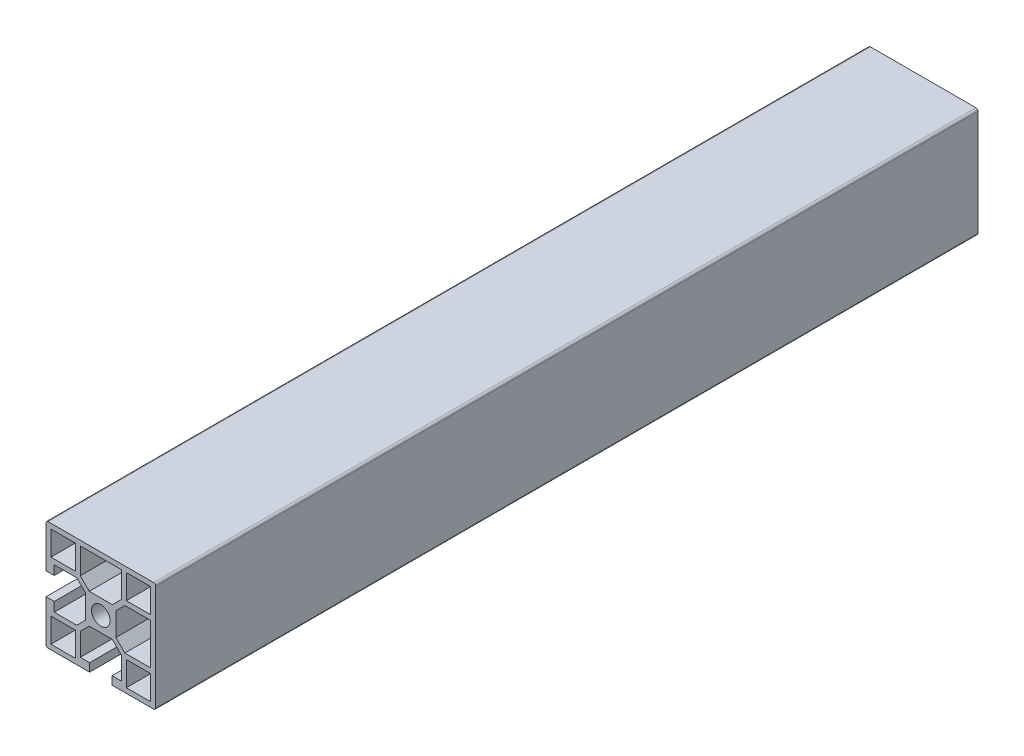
SolidWorks part; units mm, degrees
ref_plane "前视基准面" through (0, 0, 0) normal (0, 0, 1) x (1, 0, 0)
ref_plane "上视基准面" through (0, 0, 0) normal (0, 1, 0) x (1, 0, 0)
ref_plane "右视基准面" through (0, 0, 0) normal (1, 0, 0) x (0, 0, -1)
sketch "Model" plane through (0, 0, 0) normal (0, 0, 1) x (1, 0, 0)
  line L0 (8044.1793, 2616.1728) -> (8044.1793, 2607.2728)
  line L1 (8044.1793, 2607.2728) -> (8035.2793, 2607.2728)
  line L2 (8035.2793, 2607.2728) -> (8035.2793, 2616.1728)
  line L3 (8035.2793, 2616.1728) -> (8044.1793, 2616.1728)
  line L4 (8044.1793, 2643.6728) -> (8044.1793, 2634.7728)
  line L5 (8044.1793, 2634.7728) -> (8035.2793, 2634.7728)
  line L6 (8035.2793, 2634.7728) -> (8035.2793, 2643.6728)
  line L7 (8035.2793, 2643.6728) -> (8044.1793, 2643.6728)
  line L8 (8057.7065, 2630.9728) -> (8049.2521, 2630.9728)
  line L9 (8049.2521, 2630.9728) -> (8045.9793, 2634.2456)
  line L10 (8045.9793, 2634.2456) -> (8045.9793, 2643.6728)
  line L11 (8045.9793, 2643.6728) -> (8060.9793, 2643.6728)
  line L12 (8060.9793, 2643.6728) -> (8060.9793, 2634.2456)
  line L13 (8060.9793, 2634.2456) -> (8057.7065, 2630.9728)
  line L14 (8062.7793, 2607.2728) -> (8062.7793, 2616.1728)
  line L15 (8062.7793, 2616.1728) -> (8071.6793, 2616.1728)
  line L16 (8071.6793, 2616.1728) -> (8071.6793, 2607.2728)
  line L17 (8071.6793, 2607.2728) -> (8062.7793, 2607.2728)
  line L18 (8062.2521, 2632.9728) -> (8071.6793, 2632.9728)
  line L19 (8071.6793, 2632.9728) -> (8071.6793, 2617.9728)
  line L20 (8071.6793, 2617.9728) -> (8062.2521, 2617.9728)
  line L21 (8062.2521, 2617.9728) -> (8058.9793, 2621.2456)
  line L22 (8058.9793, 2621.2456) -> (8058.9793, 2629.7)
  line L23 (8058.9793, 2629.7) -> (8062.2521, 2632.9728)
  line L24 (8062.7793, 2634.7728) -> (8062.7793, 2643.6728)
  line L25 (8062.7793, 2643.6728) -> (8071.6793, 2643.6728)
  line L26 (8071.6793, 2643.6728) -> (8071.6793, 2634.7728)
  line L27 (8071.6793, 2634.7728) -> (8062.7793, 2634.7728)
  line L28 (8072.7293, 2645.4728) -> (8034.2293, 2645.4728)
  line L29 (8033.4793, 2644.7228) -> (8033.4793, 2629.5728)
  line L30 (8033.4793, 2629.5728) -> (8036.4793, 2629.5728)
  line L31 (8036.4793, 2629.5728) -> (8036.4793, 2632.9728)
  line L32 (8036.4793, 2632.9728) -> (8044.7065, 2632.9728)
  line L33 (8044.7065, 2632.9728) -> (8047.9793, 2629.7)
  line L34 (8047.9793, 2629.7) -> (8047.9793, 2621.2456)
  line L35 (8047.9793, 2621.2456) -> (8044.7065, 2617.9728)
  line L36 (8044.7065, 2617.9728) -> (8036.4793, 2617.9728)
  line L37 (8036.4793, 2617.9728) -> (8036.4793, 2621.3728)
  line L38 (8036.4793, 2621.3728) -> (8033.4793, 2621.3728)
  line L39 (8033.4793, 2621.3728) -> (8033.4793, 2606.2228)
  line L40 (8034.2293, 2605.4728) -> (8049.3793, 2605.4728)
  line L41 (8049.3793, 2605.4728) -> (8049.3793, 2608.4728)
  line L42 (8049.3793, 2608.4728) -> (8045.9793, 2608.4728)
  line L43 (8045.9793, 2608.4728) -> (8045.9793, 2616.7)
  line L44 (8045.9793, 2616.7) -> (8049.2521, 2619.9728)
  line L45 (8049.2521, 2619.9728) -> (8057.7065, 2619.9728)
  line L46 (8057.7065, 2619.9728) -> (8060.9793, 2616.7)
  line L47 (8060.9793, 2616.7) -> (8060.9793, 2608.4728)
  line L48 (8060.9793, 2608.4728) -> (8057.5793, 2608.4728)
  line L49 (8057.5793, 2608.4728) -> (8057.5793, 2605.4728)
  line L50 (8057.5793, 2605.4728) -> (8072.7293, 2605.4728)
  line L51 (8073.4793, 2606.2228) -> (8073.4793, 2644.7228)
  circle A0 centre (8053.4793, 2625.4728) radius 3.4
  arc A1 (8034.2293, 2645.4728) -> (8033.4793, 2644.7228) centre (8034.2293, 2644.7228) ccw
  arc A2 (8033.4793, 2606.2228) -> (8034.2293, 2605.4728) centre (8034.2293, 2606.2228) ccw
  arc A3 (8072.7293, 2605.4728) -> (8073.4793, 2606.2228) centre (8072.7293, 2606.2228) ccw
  arc A4 (8073.4793, 2644.7228) -> (8072.7293, 2645.4728) centre (8072.7293, 2644.7228) ccw
extrude "凸台-拉伸1" add sketch "Model" along normal blind 300
